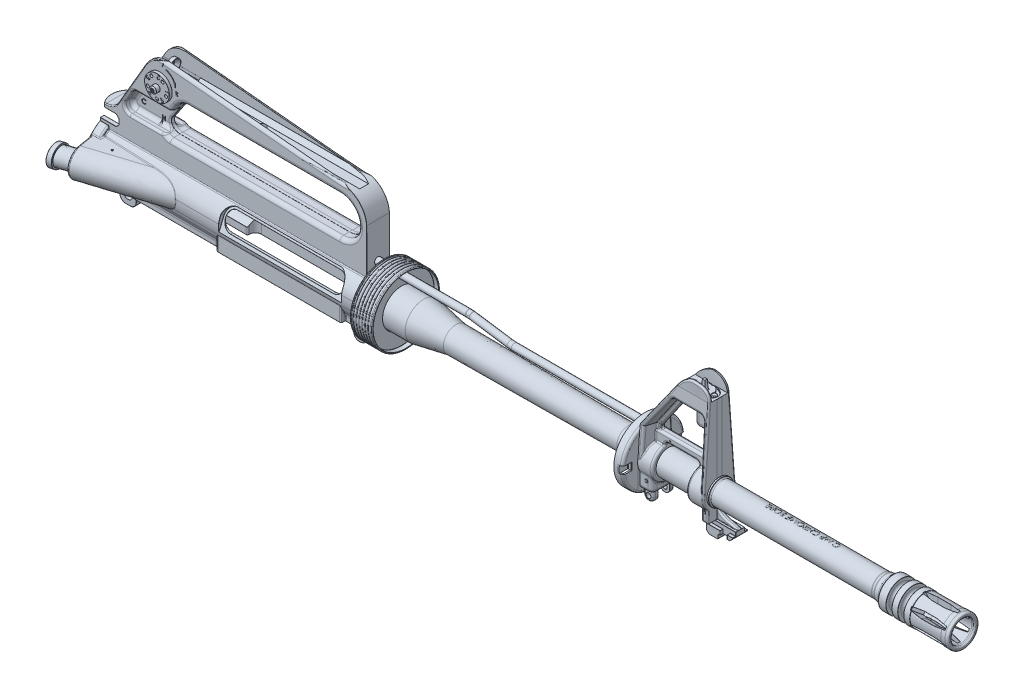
SolidWorks part; units mm, degrees
ref_plane "Front Plane" through (0, 0, 0) normal (0, 0, 1) x (1, 0, 0)
ref_plane "Top Plane" through (0, 0, 0) normal (0, 1, 0) x (1, 0, 0)
ref_plane "Right Plane" through (0, 0, 0) normal (1, 0, 0) x (0, 0, -1)
body saved out of another part "Stock-גוף עליון-1"
